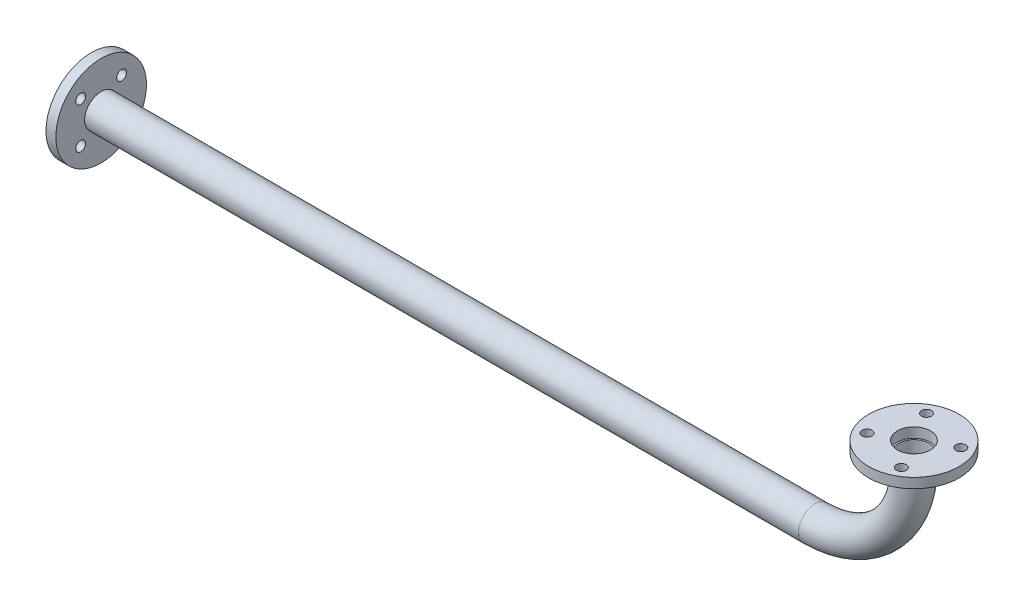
SolidWorks part; units mm, degrees
ref_plane "Plan de face" through (0, 0, 0) normal (0, 0, 1) x (1, 0, 0)
ref_plane "Plan de dessus" through (0, 0, 0) normal (0, 1, 0) x (1, 0, 0)
ref_plane "Plan de droite" through (0, 0, 0) normal (1, 0, 0) x (0, 0, -1)
sketch "Esquisse1" plane through (0, 0, 0) normal (0, 0, 1) x (1, 0, 0)
  line L0 (0, 0) -> (0, -22)
  line L1 (-180, -202) -> (-1480, -202)
  arc A0 (0, -22) -> (-180, -202) centre (-180, -22) cw
  point P6 (0, -202)
  dimension "D3" = 180
  dimension "D1" = 202
  dimension "D2" = 1480
other "Tube circulaire 60.3X2.9(1)"
ref_plane "Plan4" through (0, 0, 0) normal (0, -1, 0) x (1, 0, 0)
sketch "Esquisse13" plane through (0, 0, 0) normal (0, -1, 0) x (1, 0, 0)
  circle A0 centre (0, 0) radius 30.15
  circle A1 centre (0, 0) radius 27.25
  point P4 (0, 0)
  dimension "D1" = 60.3
  dimension "D2" = 2.9
sketch "Esquisse14" plane through (-1480, 0, 0) normal (-1, 0, 0) x (0, 0, 1)
  line L0 (0, -139.5) -> (0, -202) construction
  line L1 (0, -202) -> (-62.5, -202) construction
  line L2 (0, -202) -> (-44.1942, -157.8058) construction
  circle A0 centre (0, -202) radius 30.15 construction
  circle A2 centre (0, -202) radius 27.25 construction
  circle A3 centre (0, -202) radius 27.25
  circle A6 centre (0, -202) radius 30.15
  circle A7 centre (0, -202) radius 82.5
  circle A8 centre (-44.1942, -246.1942) radius 10
  circle A13 centre (44.1942, -157.8058) radius 10
  circle A15 centre (0, -202) radius 62.5 construction
  circle A21 centre (-44.1942, -157.8058) radius 10
  circle A22 centre (44.1942, -246.1942) radius 10
  dimension "D1" = 125
  dimension "D2" = 165
  dimension "D3" = 45
sketch "Esquisse15" plane through (-1480, 0, 0) normal (-1, 0, 0) x (0, 0, 1)
  line L0 (-52.7271, -202) -> (0, -202) construction
  line L1 (0, -202) -> (0, -149.2729) construction
  line L2 (0, -202) -> (-37.2837, -164.7163) construction
  circle A0 centre (0, -202) radius 30.15 construction
  circle A1 centre (0, -202) radius 30.15
  circle A2 centre (0, -202) radius 52.7271 construction
  circle A3 centre (0, -202) radius 82.5
  circle A4 centre (-37.2837, -164.7163) radius 9
  circle A5 centre (37.2837, -164.7163) radius 9
  circle A6 centre (37.2837, -239.2837) radius 9
  circle A7 centre (-37.2837, -239.2837) radius 9
  dimension "D1" = 165
  dimension "D2" = 165
  dimension "D3" = 18
  dimension "D4" = 45
base flange "Tôle de base pliée1" sketch "Esquisse15" thickness 18 reverse thickness direction yes parameters "D1"=10
sketch "Esquisse20" plane through (0, 0, 0) normal (0, 1, 0) x (1, 0, 0)
  line L0 (-62.5, 0) -> (0, 0) construction
  line L1 (0, 0) -> (0, 62.5) construction
  line L2 (0, 0) -> (-31.25, 54.1266) construction
  line L3 (0, 0) -> (-54.1266, -31.25) construction
  circle A0 centre (0, 0) radius 30.15 construction
  circle A1 centre (0, 0) radius 30.15
  circle A2 centre (0, 0) radius 62.5 construction
  circle A3 centre (0, 0) radius 82.5
  circle A8 centre (-31.25, 54.1266) radius 9
  circle A12 centre (-54.1266, -31.25) radius 9
  circle A13 centre (54.1266, 31.25) radius 9
  circle A14 centre (31.25, -54.1266) radius 9
  dimension "D1" = 165
  dimension "D2" = 125
  dimension "D3" = 60
  dimension "D4" = 18
  dimension "D5" = 90
base flange "Tôle de base pliée2" sketch "Esquisse20" thickness 18 reverse thickness direction yes parameters "D1"=10
sketch "Lignes de pliage1" [suppressed] plane through (0, 0, 0) normal (0, 1, 0) x (1, 0, 0)
sketch "Cube de visualisation1" [suppressed] plane through (0, 0, 0) normal (0, 1, 0) x (1, 0, 0)
sheet metal parameters "Tôlerie5" thickness 18 parameters "D1"=10
flat pattern "Etat déplié5"
sketch "Lignes de pliage2" plane through (0, 0, 0) normal (0, 1, 0) x (1, 0, 0)
sketch3d "Cube de visualisation2" [suppressed]
  line L0 (82.6029, 82.3969, 0) -> (82.3968, -82.6029, 0) construction
  line L1 (-82.3969, 82.603, 0) -> (-82.603, -82.3968, 0) construction
  line L2 (82.6029, 82.3969, 0) -> (-82.3969, 82.603, 0) construction
  line L3 (82.3968, -82.6029, 0) -> (-82.603, -82.3968, 0) construction
sheet metal parameters "Tôlerie6" thickness 18 parameters "D1"=10
flat pattern "Etat déplié6"
sketch "Lignes de pliage3" plane through (0, 0, 0) normal (0, 1, 0) x (1, 0, 0)
sketch3d "Cube de visualisation3" [suppressed]
  line L0 (82.6029, 82.3969, 0) -> (82.3968, -82.6029, 0) construction
  line L1 (-82.3969, 82.603, 0) -> (-82.603, -82.3968, 0) construction
  line L2 (82.6029, 82.3969, 0) -> (-82.3969, 82.603, 0) construction
  line L3 (82.3968, -82.6029, 0) -> (-82.603, -82.3968, 0) construction
